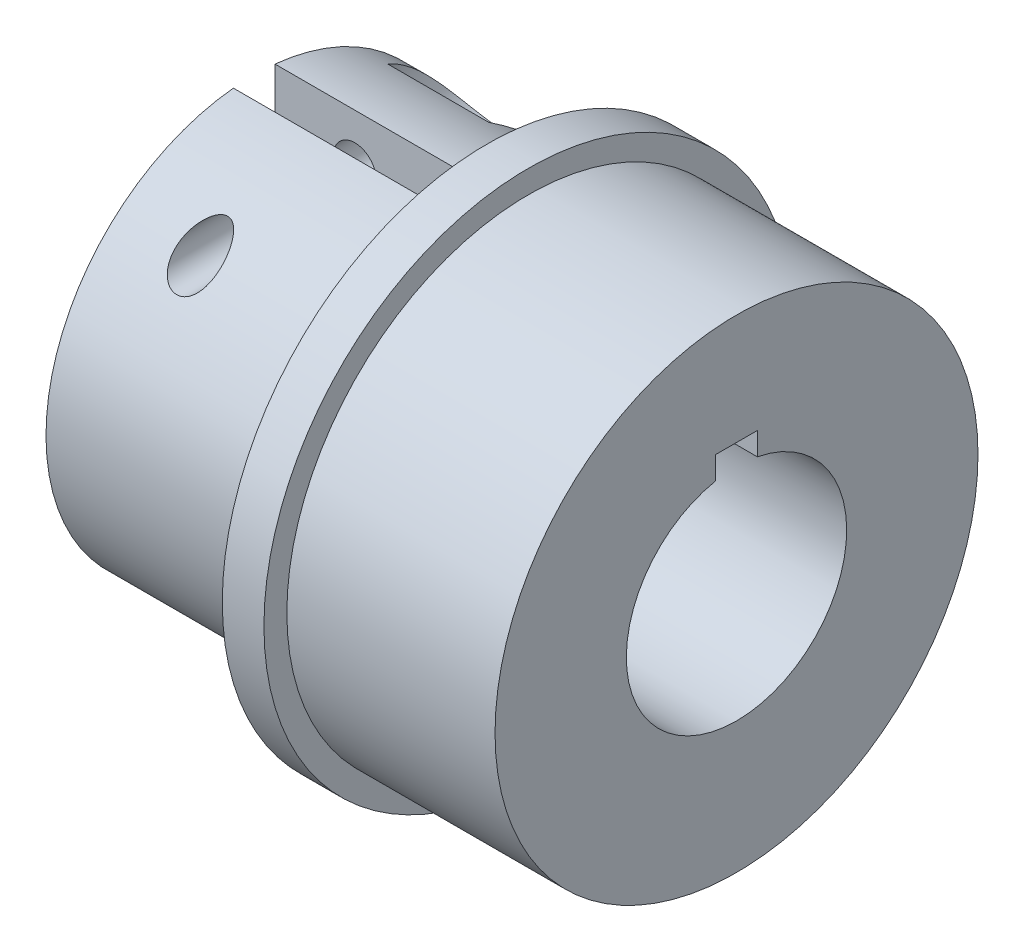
SolidWorks part; units mm, degrees
ref_plane "Front Plane" through (0, 0, 0) normal (0, 0, 1) x (1, 0, 0)
ref_plane "Top Plane" through (0, 0, 0) normal (0, 1, 0) x (1, 0, 0)
ref_plane "Right Plane" through (0, 0, 0) normal (1, 0, 0) x (0, 0, -1)
sketch "Sketch1" plane through (0, 0, 0) normal (0, 0, 1) x (1, 0, 0)
  line L0 (0, 0) -> (23.6589, 0) construction
  line L1 (0, 19.05) -> (0, 0)
  line L2 (0, 0) -> (18, 0)
  line L3 (0, 19.05) -> (3, 19.05)
  line L4 (3, 17.399) -> (3, 19.05)
  line L5 (0, 7.9375) -> (18, 7.9375)
  line L7 (3, 17.399) -> (18, 17.399)
  line L8 (18, 0) -> (18, 17.399)
  dimension "D1" = 17.399
  dimension "D3" = 3
  dimension "D4" = 15
  dimension "D5" = 7.9375
  dimension "D6" = 19.05
revolve "Revolve1" add sketch "Sketch1" angle 360 about L0
sketch "Sketch2" plane through (18, 0, 0) normal (1, 0, 0) x (0, 0, -1)
  line L1 (-1.5, 6.4375) -> (1.5, 6.4375)
  line L2 (-1.5, 6.4375) -> (-1.5, 9.4375)
  line L3 (-1.5, 9.4375) -> (1.5, 9.4375)
  line L4 (1.5, 6.4375) -> (1.5, 9.4375)
  line L5 (-1.5, 6.4375) -> (1.5, 9.4375) construction
  line L6 (-1.5, 9.4375) -> (1.5, 6.4375) construction
  circle A0 centre (0, 0) radius 7.9375 construction
  point P0 (0, 7.9375)
  dimension "D1" = 3
  dimension "D2" = 3
extrude "Cut-Extrude1" cut sketch "Sketch2" against normal through all
sketch "Sketch6" plane through (0, 0, 0) normal (-1, 0, 0) x (0, 0, 1)
  line L0 (-1.5, 9.4375) -> (1.5, 9.4375) construction
  line L1 (-1.5, 16.0695) -> (1.5, 16.0695)
  line L2 (-1.5, 16.0695) -> (-1.5, 6.8533)
  line L3 (-1.5, 6.8533) -> (1.5, 6.8533)
  line L4 (1.5, 16.0695) -> (1.5, 6.8533)
  line L5 (-1.5, 16.0695) -> (1.5, 6.8533) construction
  line L6 (-1.5, 6.8533) -> (1.5, 16.0695) construction
  circle A0 centre (0, 0) radius 7.9375
  circle A1 centre (0, 0) radius 15
  point P4 (0, 11.4614)
  point P11 (0, 9.4375)
  dimension "D1" = 3
extrude "Boss-Extrude2" add sketch "Sketch6" along normal blind 30 contours L2 A1 L4 M4 M1 M2
sketch "Sketch7" plane through (0, 0, 0) normal (0, 0, 1) x (1, 0, 0)
  line L0 (0, 19.05) -> (0, -19.05) construction
  line L1 (-3, -16.9676) -> (0, -16.9676)
  line L2 (-3, -16.9676) -> (-3, 16.9676)
  line L3 (-3, 16.9676) -> (0, 16.9676)
  line L4 (0, -16.9676) -> (0, 16.9676)
  line L5 (-3, -16.9676) -> (0, 16.9676) construction
  line L6 (-3, 16.9676) -> (0, -16.9676) construction
  point P0 (-1.5, 0)
  dimension "D1" = 3
extrude "Cut-Extrude3" cut sketch "Sketch7" against normal blind 30
sketch "Sketch8" plane through (0, 0, -1.5) normal (0, 0, 1) x (1, 0, 0)
  line L0 (-30, 11.3596) -> (-3, 11.3596) construction
  line L1 (-30, 14.9248) -> (-30, 7.7945) construction
  line L2 (-3, 7.7945) -> (-3, 14.9248) construction
  circle A0 centre (-22, 11.3596) radius 1.5335
  circle A1 centre (-11, 11.3596) radius 1.5335
  dimension "D1" = 8
  dimension "D2" = 8
extrude "Cut-Extrude4" cut sketch "Sketch8" against normal through all both and the other way through all
ref_plane "Plane1" through (0, 0, -11.5) normal (0, 0, -1) x (-1, 0, 0)
sketch "Sketch9" plane through (0, 0, -11.5) normal (0, 0, -1) x (-1, 0, 0)
  circle A0 centre (11, 11.3596) radius 4
  circle A1 centre (22, 11.3596) radius 4
extrude "Cut-Extrude5" cut sketch "Sketch9" against normal blind 4 and the other way through all
sketch "Sketch10" plane through (0, 0, 0) normal (0, 0, 1) x (1, 0, 0)
  line L1 (-16.7523, 15.4563) -> (-32.162, 15.4563)
  line L2 (-16.7523, 15.4563) -> (-16.7523, -17.2789)
  line L3 (-16.7523, -17.2789) -> (-32.162, -17.2789)
  line L4 (-32.162, 15.4563) -> (-32.162, -17.2789)
extrude "Cut-Extrude6" cut sketch "Sketch10" against normal through all both and the other way through all
